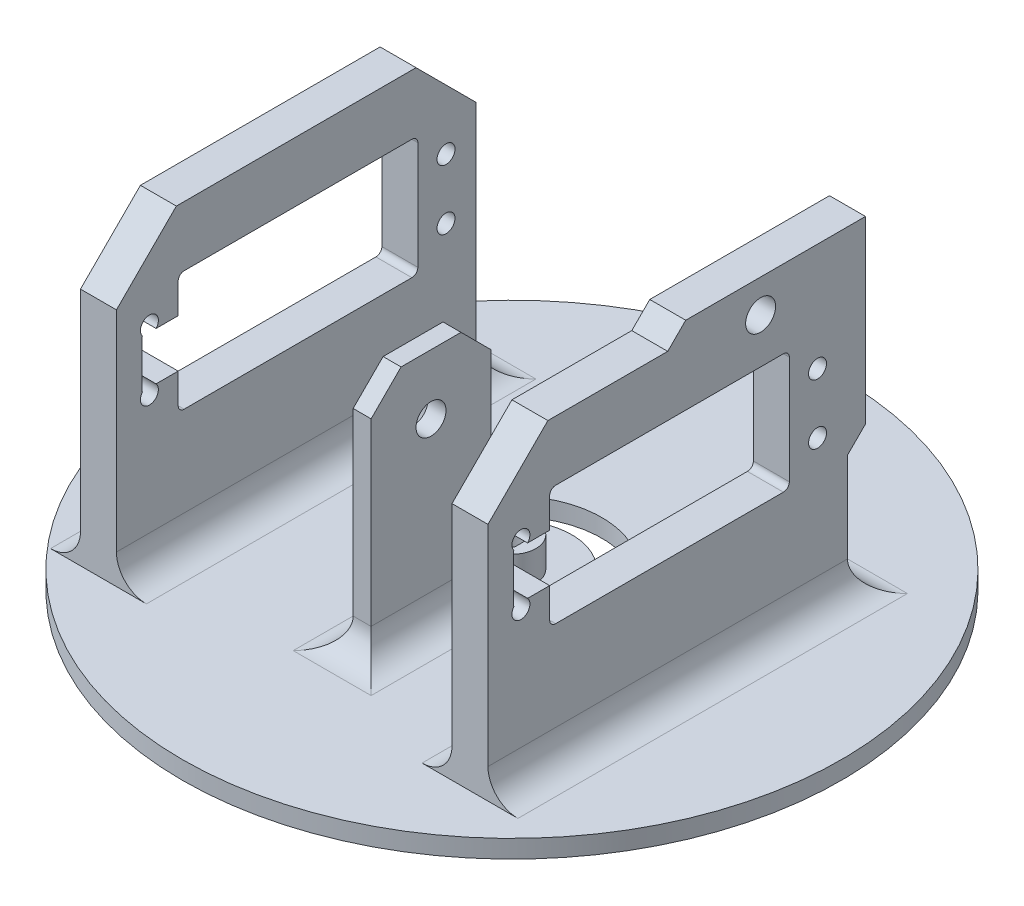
SolidWorks part; units mm, degrees
ref_plane "Alzado" through (0, 0, 0) normal (0, 0, 1) x (1, 0, 0)
ref_plane "Planta" through (0, 0, 0) normal (0, 1, 0) x (1, 0, 0)
ref_plane "Vista lateral" through (0, 0, 0) normal (1, 0, 0) x (0, 0, -1)
sketch "Croquis1" plane through (0, 0, 0) normal (0, 1, 0) x (1, 0, 0)
  circle A0 centre (0, 0) radius 55
  dimension "D1" = 110
extrude "Saliente-Extruir1" add sketch "Croquis1" along normal mid plane 3 contours A0
sketch "Croquis2" plane through (0, 1.5, 0) normal (0, 1, 0) x (1, 0, 0)
  line L0 (0, 0) -> (50000, 0) construction
  line L1 (0, 0) -> (0, -50000) construction
  line L2 (-10.6066, 10.6066) -> (-7.0711, 7.0711)
  line L3 (7.0711, 7.0711) -> (10.6066, 10.6066)
  line L4 (0, 0) -> (-10.6066, 10.6066) construction
  line L5 (0, 0) -> (10.6066, 10.6066) construction
  line L6 (2, 1.5) -> (2, -1.5)
  arc A0 (2, 1.5) -> (2, -1.5) centre (0, 0) ccw
  arc A1 (-7.0711, 7.0711) -> (7.0711, 7.0711) centre (0, 0) cw
  arc A2 (-10.6066, 10.6066) -> (10.6066, 10.6066) centre (0, 0) cw
  dimension "D2" = 5
  dimension "D3" = 10
  dimension "D4" = 15
  dimension "D5" = 2
  dimension "D1" = 45
extrude "Cortar-Extruir1" cut sketch "Croquis2" against normal through all
sketch "Croquis3" plane through (0, 1.5, 0) normal (0, 1, 0) x (1, 0, 0)
  line L0 (0, 0) -> (0, -15) construction
  line L1 (-1.5, -25) -> (1.5, -25)
  line L2 (-1.5, -25) -> (-1.5, -5)
  line L3 (-1.5, -5) -> (1.5, -5)
  line L4 (1.5, -25) -> (1.5, -5)
  line L5 (-1.5, -25) -> (1.5, -5) construction
  line L6 (-1.5, -5) -> (1.5, -25) construction
  point P0 (0, -15)
  dimension "D1" = 20
  dimension "D2" = 3
  dimension "D3" = 15
extrude "Saliente-Extruir2" add sketch "Croquis3" along normal blind 40
fillet "Redondeo1" radius 5 3 edges at (1.5, 1.5, 15) (-1.5, 1.5, 15) (0, 1.5, 25)
chamfer "Chaflán1" distance 5 angle 45 2 edges at (0, 41.5, 5) (0, 41.5, 25)
sketch "Croquis4" plane through (1.5, 0, 0) normal (1, 0, 0) x (0, 0, -1)
  line L1 (-15, 31.5) -> (-15, 41.5) construction
  line L2 (-20, 41.5) -> (-10, 41.5) construction
  circle A0 centre (-15, 31.5) radius 2.5
  dimension "D1" = 10
  dimension "D2" = 5
extrude "Cortar-Extruir2" cut sketch "Croquis4" against normal through all
sketch "Croquis5" plane through (0, 1.5, 0) normal (0, 1, 0) x (1, 0, 0)
  line L1 (25.5, 24.5) -> (31.5, 24.5)
  line L2 (25.5, 24.5) -> (25.5, -35.5)
  line L3 (25.5, -35.5) -> (31.5, -35.5)
  line L4 (31.5, 24.5) -> (31.5, -35.5)
  line L5 (-36.5, 24.5) -> (-30.5, 24.5)
  line L6 (-36.5, 24.5) -> (-36.5, -35.5)
  line L7 (-36.5, -35.5) -> (-30.5, -35.5)
  line L8 (-30.5, 24.5) -> (-30.5, -35.5)
  dimension "D1" = 6
  dimension "D2" = 60
  dimension "D3" = 25.5
  dimension "D4" = 24.5
  dimension "D5" = 30.5
extrude "Saliente-Extruir3" add sketch "Croquis5" along normal blind 50 contours L4 L1 L2 L3 | L8 L7 L6 L5
fillet "Redondeo3" radius 5 1 edges at (-36.5, 1.5, 5.5)
fillet "Redondeo4" radius 5 1 edges at (25.5, 1.5, 5.5)
fillet "Redondeo5" radius 5 1 edges at (-30.5, 1.5, 5.5)
fillet "Redondeo6" radius 5 1 edges at (31.5, 1.5, 5.5)
fillet "Redondeo7" radius 5 3 edges at (24.0355, 2.9645, -24.5) (32.9645, 2.9645, -24.5) (28.5, 1.5, -24.5)
fillet "Redondeo8" radius 5 3 edges at (-37.9645, 2.9645, -24.5) (-29.0355, 2.9645, -24.5) (-33.5, 1.5, -24.5)
sketch "Croquis6" plane through (0, 1.5, 0) normal (0, 1, 0) x (1, 0, 0)
  line L0 (2, -1.5) -> (2, 1.5) construction
  line L1 (2, -1.5) -> (2, 1.5)
  arc A0 (2, 1.5) -> (2, -1.5) centre (0, 0) ccw construction
  arc A1 (2, 1.5) -> (2, -1.5) centre (0, 0) ccw
  circle A2 centre (0, 0) radius 4
  dimension "D1" = 8
extrude "Saliente-Extruir4" add sketch "Croquis6" along normal blind 5
chamfer "Chaflán2" distance 10 angle 45 4 edges at (-33.5, 51.5, -24.5) (28.5, 51.5, -24.5) (-33.5, 51.5, 35.5) (28.5, 51.5, 35.5)
sketch "Croquis7" plane through (31.5, 0, 0) normal (1, 0, 0) x (0, 0, -1)
  line L0 (55, 1.5) -> (-55, 1.5) construction
  line L1 (-25.2, 41.5) -> (14.8, 41.5) construction
  line L2 (-25.2, 41.5) -> (-25.2, 21.5) construction
  line L3 (-25.2, 21.5) -> (14.8, 21.5) construction
  line L4 (14.8, 41.5) -> (14.8, 21.5) construction
  line L5 (-25.2, 41.5) -> (14.8, 21.5) construction
  line L6 (-25.2, 21.5) -> (14.8, 41.5) construction
  line L7 (24.5, 41.5) -> (24.5, 6.5) construction
  line L8 (-5.2, 31.5) -> (-5.2, 50031.5) construction
  line L9 (-5.2, 31.5) -> (49994.8, 31.5) construction
  line L10 (-24.2, 41.5) -> (13.8, 41.5)
  line L11 (14.8, 40.5) -> (14.8, 22.5)
  line L12 (13.8, 21.5) -> (-24.2, 21.5)
  line L13 (-25.2, 22.5) -> (-25.2, 27.5)
  line L14 (-25.2, 27.5) -> (-31.2, 27.5)
  line L15 (-31.2, 27.5) -> (-31.2, 35.5)
  line L16 (-31.2, 35.5) -> (-25.2, 35.5)
  line L17 (-25.2, 35.5) -> (-25.2, 40.5)
  arc A0 (13.8, 41.5) -> (14.8, 40.5) centre (13.8, 40.5) cw
  arc A1 (13.8, 21.5) -> (14.8, 22.5) centre (13.8, 22.5) ccw
  arc A2 (-24.2, 21.5) -> (-25.2, 22.5) centre (-24.2, 22.5) cw
  arc A3 (-24.2, 41.5) -> (-25.2, 40.5) centre (-24.2, 40.5) ccw
  point P0 (-5.2, 31.5)
  point P25 (-31.2, 31.5)
  dimension "D5" = 1
  dimension "D1" = 20
  dimension "D2" = 40
  dimension "D3" = 20
  dimension "D4" = 9.7
  dimension "D6" = 8
  dimension "D7" = 6
extrude "Cortar-Extruir3" cut sketch "Croquis7" against normal up to next contours L10 A0 L11 A1 L12 A2 L13 L14 L15 L16 L17 A3
sketch "Croquis8" plane through (31.5, 0, 0) normal (1, 0, 0) x (0, 0, -1)
  arc A0 (16.15, 26.5) -> (21.9, 24.1628) centre (19.5, 26.5) ccw construction
  arc A1 (16.25, 36.5) -> (21.8284, 34.2326) centre (19.5, 36.5) ccw construction
  arc A2 (-26.75, 26.5) -> (-32.3284, 28.7674) centre (-30, 26.5) ccw construction
  arc A3 (-32.4, 34.1628) -> (-26.65, 36.5) centre (-30, 36.5) ccw construction
  arc A4 (16.15, 26.5) -> (21.9, 24.1628) centre (19.5, 26.5) ccw construction
  arc A5 (16.25, 36.5) -> (21.8284, 34.2326) centre (19.5, 36.5) ccw construction
  arc A6 (-26.75, 26.5) -> (-32.3284, 28.7674) centre (-30, 26.5) ccw construction
  arc A7 (-32.4, 34.1628) -> (-26.65, 36.5) centre (-30, 36.5) ccw construction
  circle A8 centre (-30, 36.5) radius 1.5
  circle A9 centre (19.5, 36.5) radius 1.5
  circle A10 centre (-30, 26.5) radius 1.5
  circle A11 centre (19.5, 26.5) radius 1.5
  dimension "D1" = 3
extrude "Cortar-Extruir4" cut sketch "Croquis8" against normal through all
sketch "Croquis9" plane through (31.5, 0, 0) normal (1, 0, 0) x (0, 0, -1)
sketch "Croquis10" plane through (-36.5, 0, 0) normal (-1, 0, 0) x (0, 0, 1)
  line L6 (28.882, 35.5) -> (25.2, 35.5) construction
  line L7 (31.2, 27.5) -> (31.2, 35.5) construction
  line L8 (25.2, 27.5) -> (28.882, 27.5) construction
  line L9 (25.2, 22.5) -> (25.2, 27.5) construction
  line L10 (25.2, 35.5) -> (25.2, 40.5) construction
  line L11 (-13.8, 21.5) -> (24.2, 21.5) construction
  line L12 (24.2, 41.5) -> (-13.8, 41.5) construction
  line L13 (-14.8, 40.5) -> (-14.8, 22.5) construction
  line L14 (28.882, 35.5) -> (25.2, 35.5)
  line L15 (31.2, 27.5) -> (31.2, 35.5)
  line L16 (25.2, 27.5) -> (28.882, 27.5)
  line L17 (25.2, 22.5) -> (25.2, 27.5)
  line L18 (25.2, 35.5) -> (25.2, 40.5)
  line L19 (-13.8, 21.5) -> (24.2, 21.5)
  line L20 (24.2, 41.5) -> (-13.8, 41.5)
  line L21 (-14.8, 40.5) -> (-14.8, 22.5)
  line L22 (28.882, 35.5) -> (31.2, 35.5)
  line L23 (31.2, 27.5) -> (28.882, 27.5)
  arc A6 (-13.8, 41.5) -> (-14.8, 40.5) centre (-13.8, 40.5) ccw construction
  arc A7 (-14.8, 22.5) -> (-13.8, 21.5) centre (-13.8, 22.5) ccw construction
  arc A8 (24.2, 21.5) -> (25.2, 22.5) centre (24.2, 22.5) ccw construction
  arc A9 (25.2, 40.5) -> (24.2, 41.5) centre (24.2, 40.5) ccw construction
  arc A10 (-13.8, 41.5) -> (-14.8, 40.5) centre (-13.8, 40.5) ccw
  arc A11 (-14.8, 22.5) -> (-13.8, 21.5) centre (-13.8, 22.5) ccw
  arc A12 (24.2, 21.5) -> (25.2, 22.5) centre (24.2, 22.5) ccw
  arc A13 (25.2, 40.5) -> (24.2, 41.5) centre (24.2, 40.5) ccw
extrude "Cortar-Extruir5" cut sketch "Croquis10" against normal up to next
sketch "Croquis11" plane through (31.5, 0, 0) normal (1, 0, 0) x (0, 0, -1)
  line L0 (-5.5, 51.5) -> (-2.5, 54.5)
  line L1 (14.5, 51.5) -> (-25.5, 51.5) construction
  line L2 (-2.5, 54.5) -> (27.5, 54.5)
  line L3 (27.5, 54.5) -> (27.5, 24.5)
  line L4 (27.5, 24.5) -> (24.5, 21.5)
  line L5 (24.5, 41.5) -> (24.5, 6.5) construction
  line L6 (-5.5, 51.5) -> (14.5, 51.5)
  line L7 (14.5, 51.5) -> (24.5, 41.5)
  line L8 (24.5, 41.5) -> (24.5, 21.5)
  dimension "D1" = 135
  dimension "D2" = 3
extrude "Saliente-Extruir5" add sketch "Croquis11" against normal up to surface (6 mm away)
sketch "Croquis12" plane through (31.5, 0, 0) normal (1, 0, 0) x (0, 0, -1)
  circle A0 centre (10, 49.01) radius 2.5
  point P2 (-15, 31.5)
  dimension "D1" = 5
  dimension "D2" = 25
  dimension "D3" = 17.51
extrude "Cortar-Extruir6" cut sketch "Croquis12" against normal up to next
